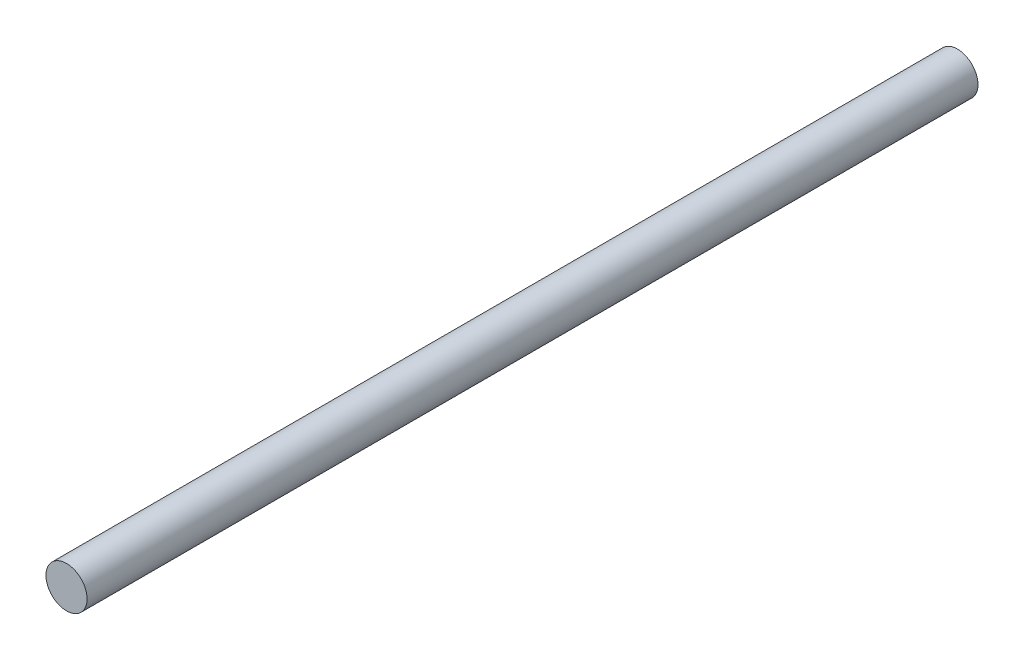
SolidWorks part; units mm, degrees
ref_plane "Plan de face" through (0, 0, 0) normal (0, 0, 1) x (1, 0, 0)
ref_plane "Plan de dessus" through (0, 0, 0) normal (0, 1, 0) x (1, 0, 0)
ref_plane "Plan de droite" through (0, 0, 0) normal (1, 0, 0) x (0, 0, -1)
sketch "Esquisse1" plane through (0, 0, 0) normal (0, 0, 1) x (1, 0, 0)
  circle A0 centre (0, 0) radius 3
  dimension "D1" = 6
extrude "Boss.-Extru.1" add sketch "Esquisse1" along normal blind 130
